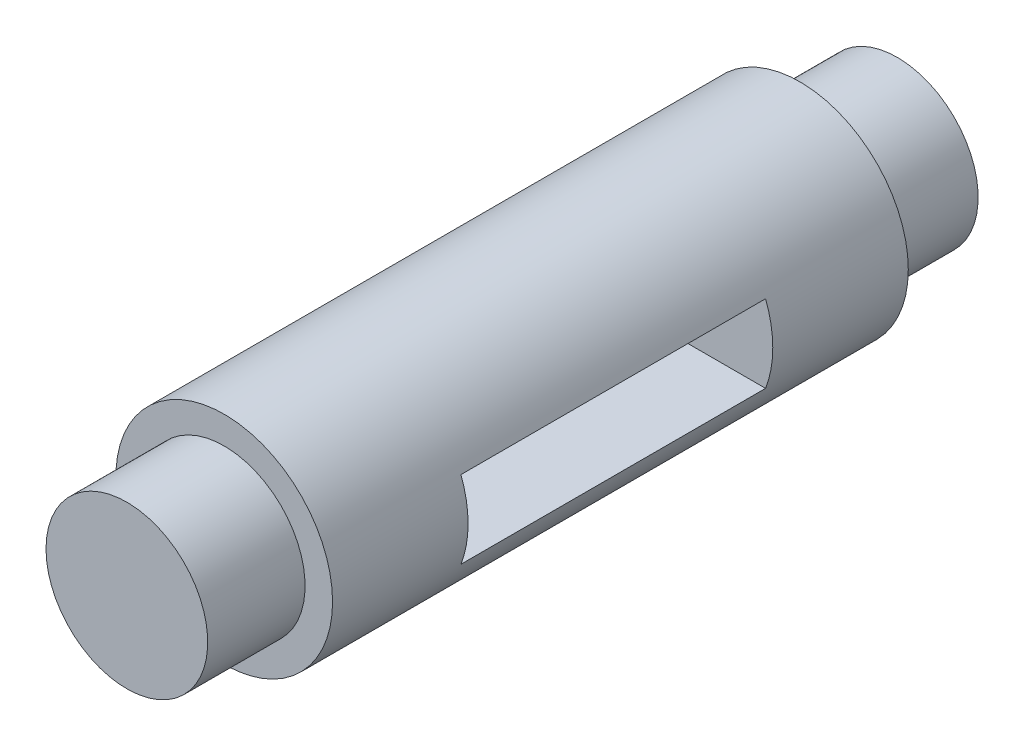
SolidWorks part; units mm, degrees
ref_plane "Front Plane" through (0, 0, 0) normal (0, 0, 1) x (1, 0, 0)
ref_plane "Top Plane" through (0, 0, 0) normal (0, 1, 0) x (1, 0, 0)
ref_plane "Right Plane" through (0, 0, 0) normal (1, 0, 0) x (0, 0, -1)
sketch "Sketch1" plane through (0, 0, 0) normal (0, 0, 1) x (1, 0, 0)
  circle A0 centre (0, 0) radius 4.2545
  circle A1 centre (0, 0) radius 3.175
  dimension "D1" = 8.509
  dimension "D2" = 6.35
extrude "Boss-Extrude1" add sketch "Sketch1" along normal mid plane 22.606
sketch "Sketch2" plane through (0, 0, 0) normal (0, 0, 1) x (1, 0, 0)
  circle A1 centre (0, 0) radius 3.175
  circle A2 centre (0, 0) radius 3.175
  dimension "D1" = 0
extrude "Boss-Extrude2" add sketch "Sketch2" along normal mid plane 30.2514
sketch "Sketch5" plane through (0, 0, 0) normal (1, 0, 0) x (0, 0, -1)
  line L0 (-5.9817, 1.524) -> (-5.9817, -1.524)
  line L1 (-5.9817, 1.524) -> (5.9817, 1.524)
  line L2 (5.9817, 1.524) -> (5.9817, -1.524)
  line L4 (0, 4.2468) -> (0, -4.7811) construction
  line L5 (-5.9817, 1.524) -> (-5.9817, -1.524)
  line L6 (-5.9817, -1.524) -> (5.9817, -1.524)
  line L7 (5.9817, 1.524) -> (5.9817, -1.524)
  dimension "D2" = 11.9634
  dimension "D5" = 3.048
extrude "Cut-Extrude2" cut sketch "Sketch5" against normal mid plane 30.2514 contours L4 L1 L0 L6 | L1 L4 L6 L2
